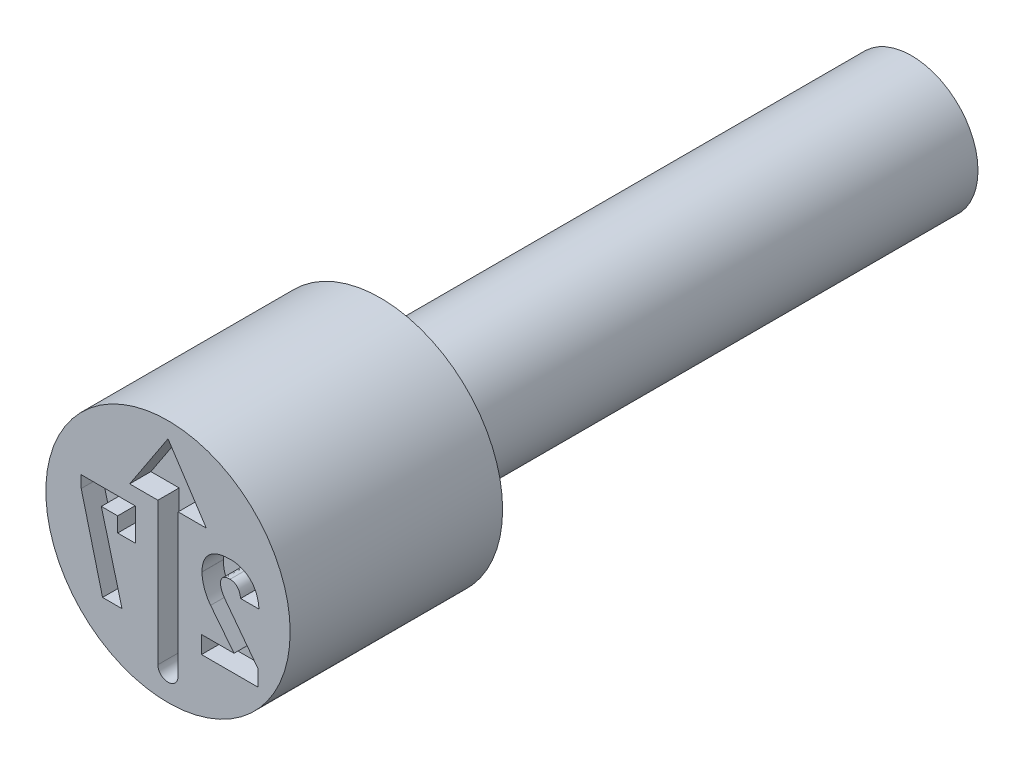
SolidWorks part; units mm, degrees
ref_plane "Front Plane" through (0, 0, 0) normal (0, 0, 1) x (1, 0, 0)
ref_plane "Top Plane" through (0, 0, 0) normal (0, 1, 0) x (1, 0, 0)
ref_plane "Right Plane" through (0, 0, 0) normal (1, 0, 0) x (0, 0, -1)
sketch "Sketch2" plane through (0, 0, 0) normal (1, 0, 0) x (0, 0, -1)
  line L0 (0.4039, 0) -> (50000.4039, 0) construction
  line L6 (0, 2.3) -> (0, 0)
  line L7 (4, 2.3) -> (0, 2.3)
  line L8 (4, 1.25) -> (4, 2.3)
  line L9 (14, 1.25) -> (4, 1.25)
  line L10 (14, 0) -> (14, 1.25)
  line L11 (0, 0) -> (14, 0)
  dimension "D1" = 4.6
  dimension "D2" = 2.5
  dimension "D3" = 14
  dimension "D4" = 4
revolve "Revolve1" add sketch "Sketch2" angle 360 about L0
sketch "Sketch3" plane through (0, 0, 0) normal (0, 0, 1) x (1, 0, 0)
  line L0 (0, 0) -> (0, 100000) construction
  line L1 (0.1905, 0.9064) -> (0.1905, -1.7762)
  line L2 (0.7219, 0.9064) -> (0.1905, 0.9064)
  line L3 (0, 2.0021) -> (0.7219, 0.9064)
  line L15 (0, 2.0021) -> (-0.7219, 0.9064)
  line L16 (-0.7219, 0.9064) -> (-0.1905, 0.9064)
  line L17 (-0.1905, 0.9064) -> (-0.1905, -1.7762)
  arc A2 (-0.1905, -1.7762) -> (0.1905, -1.7762) centre (0, -1.7762) ccw
extrude "Cut-Extrude4" cut sketch "Sketch3" against normal blind 0.4
sketch "Sketch4" plane through (0, 0, 0) normal (0, 0, 1) x (1, 0, 0)
  text T0 "2  7" font "Bahnschrift" height 1.8
  dimension "D1" = 1.2
extrude "Cut-Extrude5" cut sketch "Sketch4" against normal blind 0.4
